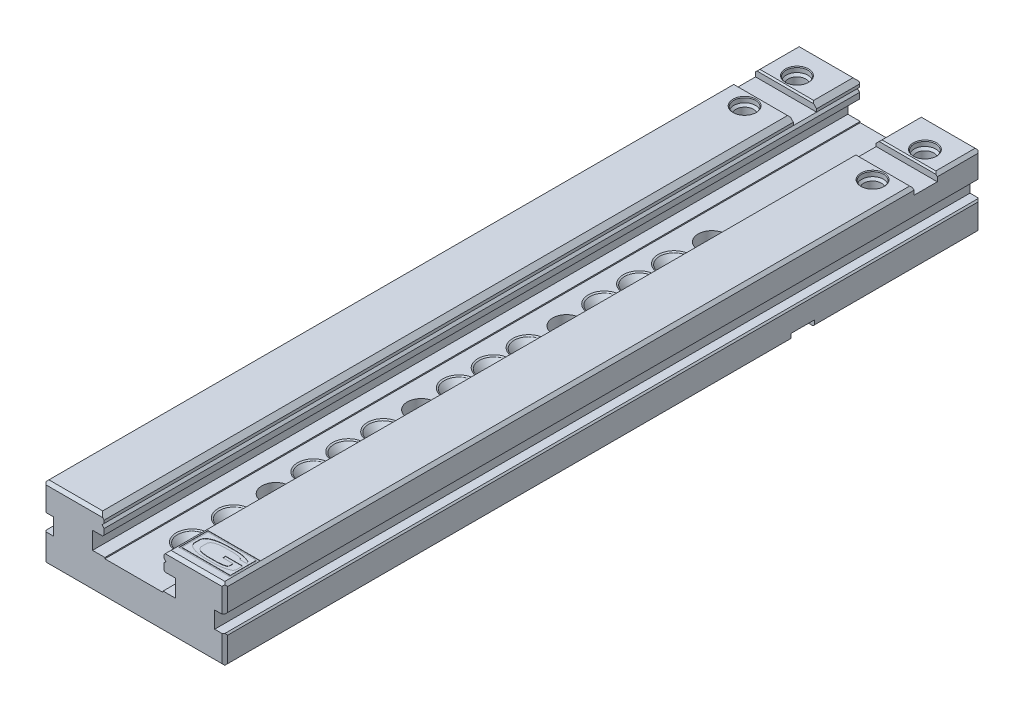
SolidWorks part; units mm, degrees
ref_plane "Front Plane" through (0, 0, 0) normal (0, 0, 1) x (1, 0, 0)
ref_plane "Top Plane" through (0, 0, 0) normal (0, 1, 0) x (1, 0, 0)
ref_plane "Right Plane" through (0, 0, 0) normal (1, 0, 0) x (0, 0, -1)
imported_body "Imported1"
sketch "Sketch1" plane through (0, 24.2, 0) normal (0, 1, 0) x (1, 0, 0)
  circle A0 centre (0, 97.5) radius 10
extrude "Boss-Extrude1" add sketch "Sketch1" against normal up to surface (24.2 mm away)
sketch "Sketch2" plane through (0, 24.2, 0) normal (0, 1, 0) x (1, 0, 0)
  circle A0 centre (0, 197.5) radius 11
  circle A1 centre (0, 297.5) radius 11
  circle A2 centre (0, 397.5) radius 11
extrude "Boss-Extrude2" add sketch "Sketch2" against normal up to surface (18.2 mm away)
hole_wizard "Hole1" positions "Sketch4" profile "Sketch3" legacy
sketch "Sketch4" plane through (0, 24.2, 0) normal (0, 1, 0) x (1, 0, 0)
  line L0 (-20.5, 520) -> (20.5, 520) construction
  line L5 (20, 519.5) -> (-20, 519.5) construction
  point P0 (0, 397.5)
  point P5 (0, 297.5)
  point P7 (0, 197.5)
  point P9 (0, 97.5)
  point P31 (0, 519.5)
  dimension "D1" = 122.5
  dimension "D2" = 100
  dimension "D3" = 100
  dimension "D4" = 100
  dimension "D5" = 0
sketch "Sketch3" plane through (0, 24.2, -397.5) normal (1, 0, 0) x (0, 0, 1)
  line L0 (0, 0) -> (0, 100)
  line L1 (0, 100) -> (6.5, 100)
  line L2 (6.5, 100) -> (6.5, 12.5)
  line L3 (6.5, 12.5) -> (9.5, 12.5)
  line L4 (9.5, 12.5) -> (9.5, 0)
  line L5 (9.5, 0) -> (0, 0)
  line L6 (0, 110) -> (0, -10) construction
  dimension "Diameter" = 13
  dimension "Depth" = 100
  dimension "C-Bore Diameter" = 19
  dimension "C-Bore Depth" = 12.5
